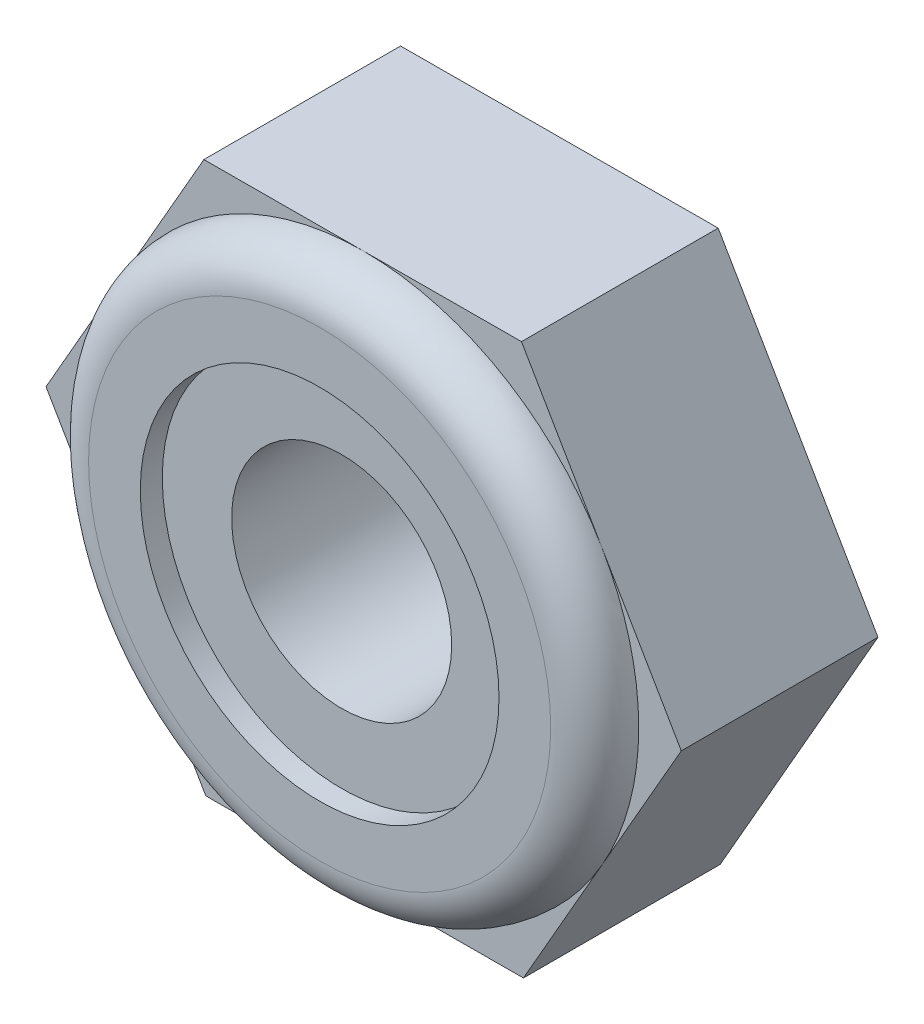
SolidWorks part; units mm, degrees
ref_plane "Front Plane" through (0, 0, 0) normal (0, 0, 1) x (1, 0, 0)
ref_plane "Top Plane" through (0, 0, 0) normal (0, 1, 0) x (1, 0, 0)
ref_plane "Right Plane" through (0, 0, 0) normal (1, 0, 0) x (0, 0, -1)
sketch "Sketch1" plane through (0, 0, 0) normal (0, 0, 1) x (1, 0, 0)
  line L1 (1.8443, -3.1685) -> (3.6662, 0.013)
  line L2 (3.6662, 0.013) -> (1.8218, 3.1815)
  line L3 (1.8218, 3.1815) -> (-1.8443, 3.1685)
  line L4 (-1.8443, 3.1685) -> (-3.6662, -0.013)
  line L5 (-3.6662, -0.013) -> (-1.8218, -3.1815)
  line L6 (-1.8218, -3.1815) -> (1.8443, -3.1685)
  circle A0 centre (0, 0) radius 3.175 construction
  dimension "D1" = 6.35
extrude "Extrude1" add sketch "Sketch1" along normal blind 2.2701
sketch "Sketch2" plane through (0, 0, 2.2701) normal (0, 0, 1) x (1, 0, 0)
  circle A0 centre (0, 0) radius 3.175
  dimension "D1" = 6.35
extrude "Extrude2" add sketch "Sketch2" along normal blind 0.508
fillet "Fillet3" radius 0.508 1 edges at (3.175, 0, 2.7781)
sketch "Sketch3" plane through (0, 0, 2.7781) normal (0, 0, 1) x (1, 0, 0)
  circle A0 centre (0, 0) radius 1.27
extrude "Cut-Extrude1" cut sketch "Sketch3" against normal through all
sketch "Sketch4" plane through (0, 0, 2.7781) normal (0, 0, 1) x (1, 0, 0)
  circle A0 centre (0, 0) radius 2.0702
extrude "Cut-Extrude2" cut sketch "Sketch4" against normal blind 0.254
